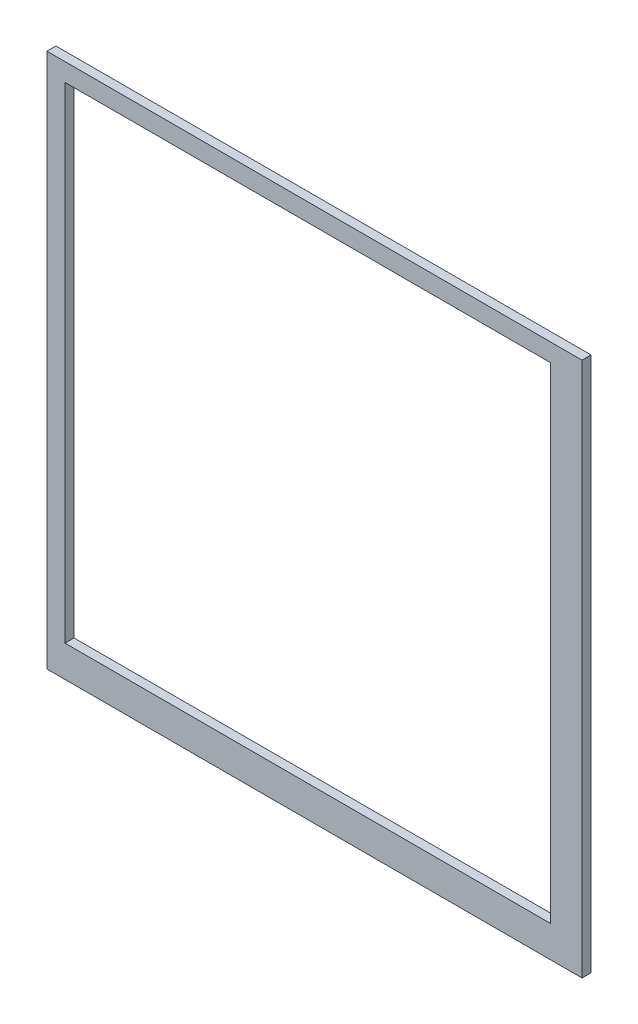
SolidWorks part; units mm, degrees
ref_plane "Front Plane" through (0, 0, 0) normal (0, 0, 1) x (1, 0, 0)
ref_plane "Top Plane" through (0, 0, 0) normal (0, 1, 0) x (1, 0, 0)
ref_plane "Right Plane" through (0, 0, 0) normal (1, 0, 0) x (0, 0, -1)
sketch "Sketch1" plane through (0, 0, 0) normal (0, 0, 1) x (1, 0, 0)
  line L0 (290, 290) -> (-290, 290)
  line L1 (270, -270) -> (-270, -270)
  line L2 (270, -270) -> (270, 270)
  line L3 (270, 270) -> (-270, 270)
  line L4 (-270, -270) -> (-270, 270)
  line L5 (270, -270) -> (-270, 270) construction
  line L6 (270, 270) -> (-270, -270) construction
  line L7 (-290, -290) -> (-290, 290)
  line L8 (290, -290) -> (-290, -290)
  line L9 (290, -290) -> (290, 290)
  point P0 (0, 0)
  dimension "D1" = 540
  dimension "D2" = 20
extrude "Boss-Extrude1" add sketch "Sketch1" along normal blind 10
sketch "Sketch2" plane through (0, 0, 0) normal (0, 0, -1) x (-1, 0, 0)
  line L2 (290, -305) -> (-290, -305)
  line L3 (290, -305) -> (-305, -305)
  line L4 (290, -290) -> (-290, -290) construction
  line L5 (-305, -290) -> (-305, 290)
  line L6 (-305, -305) -> (-305, 290)
  line L7 (-290, -290) -> (-290, 290) construction
  line L8 (290, -290) -> (-290, -290)
  line L9 (-290, -290) -> (-290, 290)
  line L10 (290, -290) -> (290, -305)
  line L11 (-290, 290) -> (-305, 290)
  dimension "D1" = 15
  dimension "D2" = 15
extrude "Boss-Extrude2" add sketch "Sketch2" against normal blind 10
